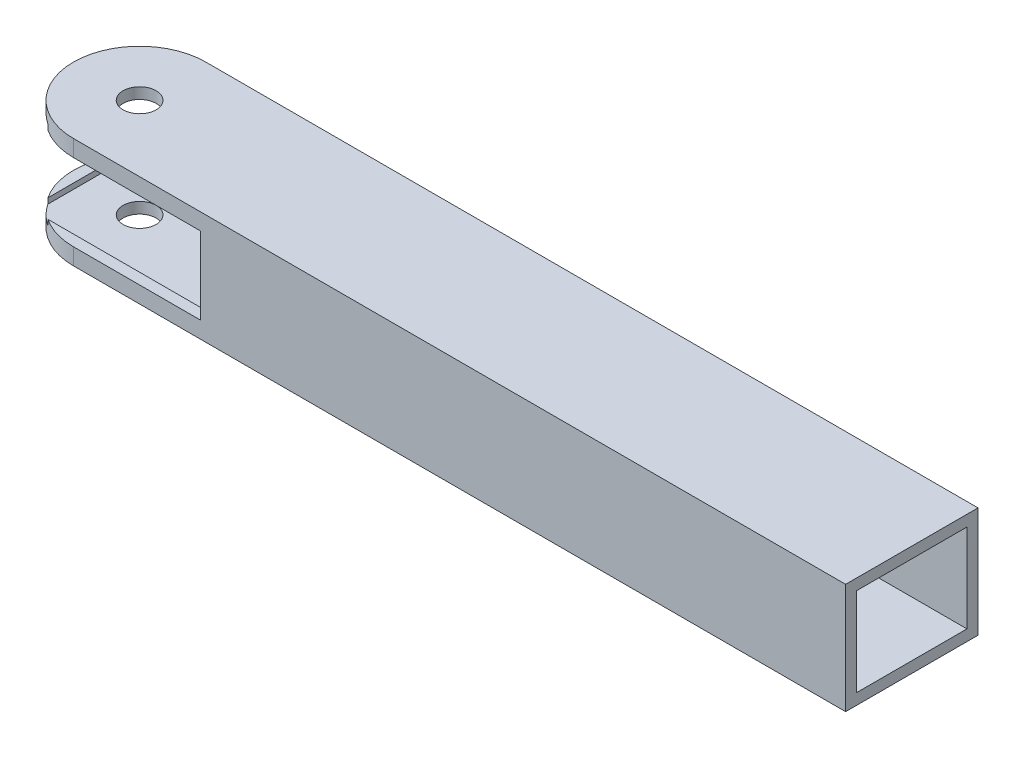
SolidWorks part; units mm, degrees
ref_plane "Płaszczyzna przednia" through (0, 0, 0) normal (0, 0, 1) x (1, 0, 0)
ref_plane "Płaszczyzna górna" through (0, 0, 0) normal (0, 1, 0) x (1, 0, 0)
ref_plane "Płaszczyzna prawa" through (0, 0, 0) normal (1, 0, 0) x (0, 0, -1)
sketch "Szkic1" plane through (0, 0, 0) normal (0, 1, 0) x (1, 0, 0)
  line L1 (0, 6) -> (70, 6)
  line L2 (0, -6) -> (70, -6)
  line L4 (70, 6) -> (70, -6)
  circle A0 centre (0, 0) radius 1.5
  arc A1 (0, 6) -> (0, -6) centre (0, 0) ccw
  point P3 (37.5, 0)
  dimension "D1" = 3
  dimension "D2" = 6
  dimension "D3" = 70
extrude "Dodanie-wyciągnięcie1" add sketch "Szkic1" along normal blind 10
sketch "Szkic2" plane through (0, 0, -6) normal (0, 0, -1) x (-1, 0, 0)
  line L8 (-11.5, 8.5) -> (23.5, 8.5)
  line L9 (-11.5, 8.5) -> (-11.5, 1.5)
  line L10 (-11.5, 1.5) -> (23.5, 1.5)
  line L11 (23.5, 8.5) -> (23.5, 1.5)
  line L12 (-11.5, 8.5) -> (23.5, 1.5) construction
  line L13 (-11.5, 1.5) -> (23.5, 8.5) construction
  line L14 (6, 0) -> (6, 10) construction
  point P7 (6, 5)
  dimension "D1" = 8.5
  dimension "D2" = 7
  dimension "D3" = 35
extrude "Wytnij-wyciągnięcie1" cut sketch "Szkic2" against normal through all
sketch "Szkic3" plane through (70, 0, 0) normal (1, 0, 0) x (0, 0, -1)
  line L17 (-5, 1) -> (5, 1)
  line L18 (5, 1) -> (5, 9)
  line L19 (5, 9) -> (-5, 9)
  line L20 (-5, 9) -> (-5, 1)
  line L21 (-5, 1) -> (5, 1)
  line L22 (5, 1) -> (5, 9)
  line L23 (5, 9) -> (-5, 9)
  line L24 (-5, 9) -> (-5, 1)
  dimension "D1" = 1
extrude "Wytnij-wyciągnięcie2" cut sketch "Szkic3" against normal blind 75 contours L23 L24 L21 L22
